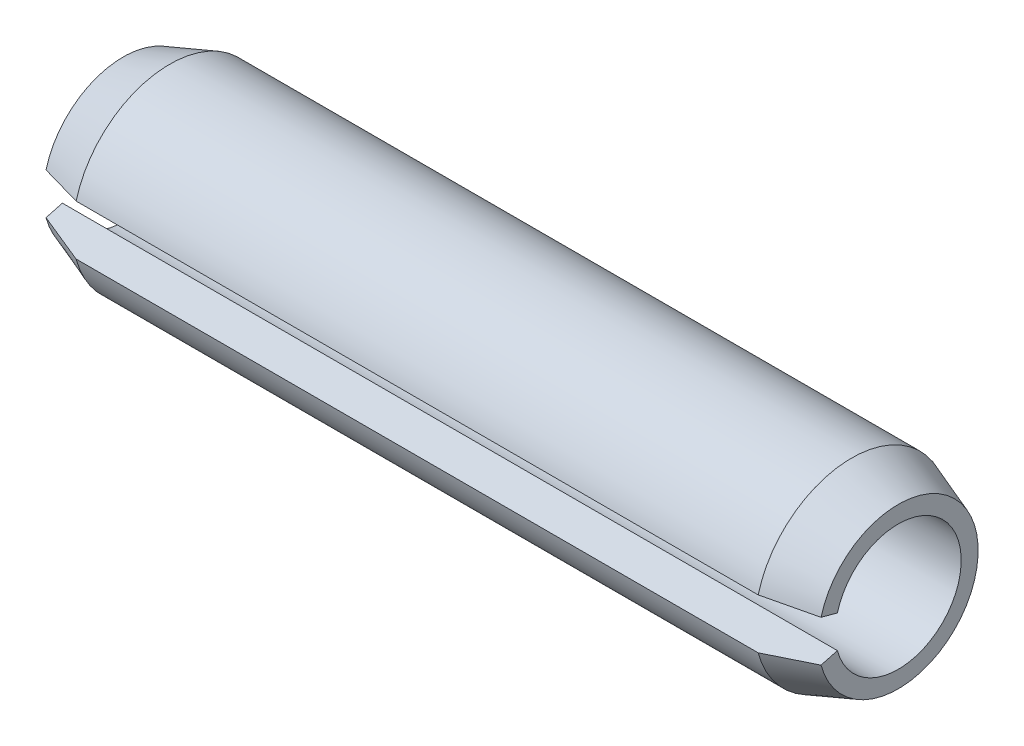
SolidWorks part; units mm, degrees
ref_plane "Front Plane" through (0, 0, 0) normal (0, 0, 1) x (1, 0, 0)
ref_plane "Top Plane" through (0, 0, 0) normal (0, 1, 0) x (1, 0, 0)
ref_plane "Right Plane" through (0, 0, 0) normal (1, 0, 0) x (0, 0, -1)
sketch "BodySke" plane through (0, 0, 0) normal (0, 1, 0) x (1, 0, 0)
  line L0 (0, 0) -> (62.838, 0) construction
  line L1 (0, 0) -> (0, 5) construction
  line L2 (0, 5) -> (40, 5) construction
  line L3 (40, 5) -> (40, 0) construction
  line L4 (0, 3.25) -> (40, 3.25)
  line L5 (0, 4.125) -> (2.4, 5)
  line L6 (20, 5) -> (20, 0) construction
  line L7 (40, 4.125) -> (37.6, 5)
  line L8 (0, 4.125) -> (0, 3.25)
  line L9 (2.4, 5) -> (37.6, 5)
  line L10 (40, 4.125) -> (40, 3.25)
  dimension "D1" = 8.25
  dimension "Pin_dia" = 10
  dimension "Hole_dia" = 6.5
  dimension "Length" = 40
  dimension "Chamfer" = 2.4
revolve "BaseBody" add sketch "BodySke" angle 360 about L0
sketch "SlitSke" plane through (0, 0, 0) normal (1, 0, 0) x (0, 0, -1)
  line L0 (-6.4036, 0) -> (7.0752, 0) construction
  line L1 (0, -5.7801) -> (0, 6.4996) construction
  line L2 (0, 0) -> (-4.8296, 1.2941)
  line L3 (0, 0) -> (-4.8296, -1.2941)
  circle A0 centre (0, 0) radius 5 construction
  arc A1 (-4.8296, 1.2941) -> (-4.8296, -1.2941) centre (0, 0) ccw
  dimension "Angle" = 15
extrude "Slit" cut sketch "SlitSke" along normal through all
equation "\"D1@BodySke\" =  ( \"Pin_dia@BodySke\" + \"Hole_dia@BodySke\" )  / 2"
